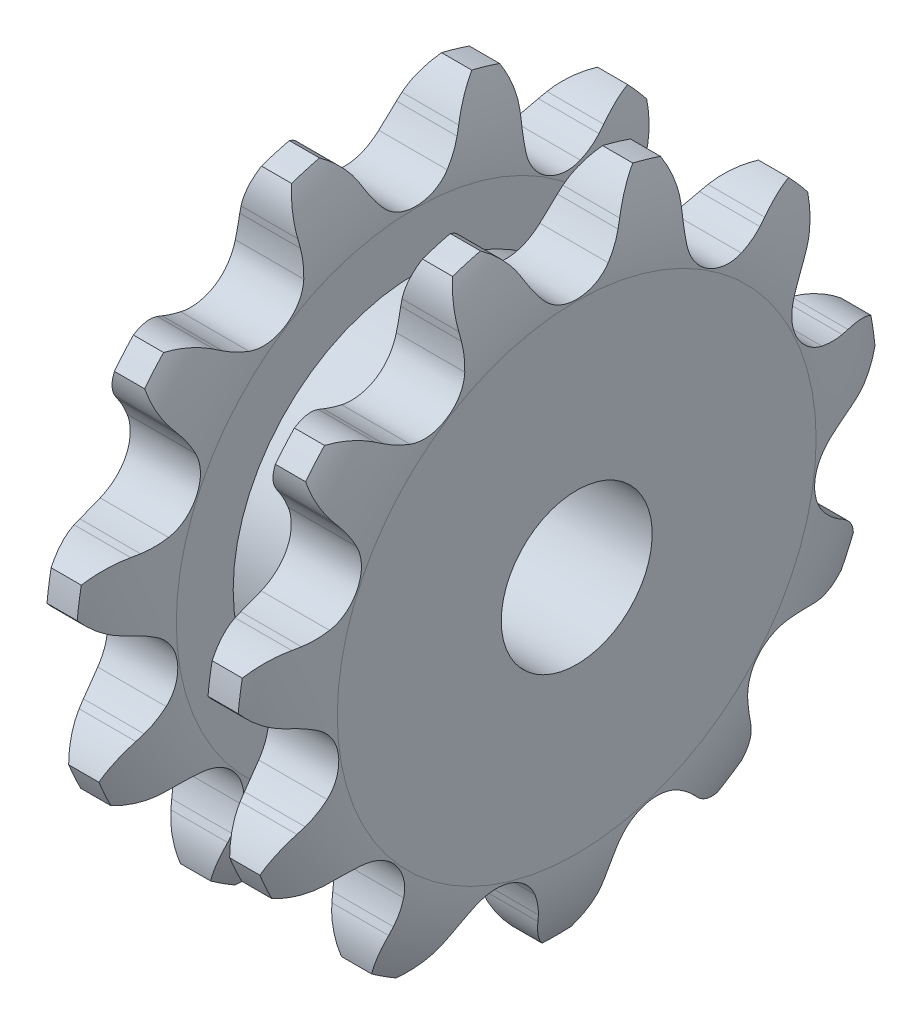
SolidWorks part; units mm, degrees
ref_plane "Plane1" through (0, 0, 0) normal (0, 0, 1) x (1, 0, 0)
ref_plane "Plane2" through (0, 0, 0) normal (0, 1, 0) x (1, 0, 0)
ref_plane "Plane3" through (0, 0, 0) normal (1, 0, 0) x (0, 0, -1)
sketch "Clipboard" plane through (0, 0, 0) normal (0, 1, 0) x (1, 0, 0)
  line L0 (0, 0) -> (6.2333, -1.2116)
  line L1 (-15, 0) -> (100, 0) construction
  line L2 (0, 0) -> (-0.5301, 0.5991)
  line L3 (0, 0) -> (-2.9891, 1.1425)
  line L4 (0, 0) -> (3.043, 0.5915)
  line L5 (0, 0) -> (-89.0105, -33.1983)
  line L6 (0, 0) -> (-7.6265, -5.1456)
  line L7 (-0.5301, 0.5991) -> (92.0355, 21.9696)
  line L8 (-76.2, 38.1) -> (-75.2, 38.1)
  line L9 (-73.2358, 39.4872) -> (-73.0836, 39.4947)
  line L10 (-73.0533, 76.1892) -> (-66.6533, 76.1892)
  circle A0 centre (0, 0) radius 1.651
  circle A1 centre (0, 0) radius 4
  circle A2 centre (0, 0) radius 4
sketch "BasProSke" plane through (0, 0, 0) normal (0, 1, 0) x (1, 0, 0)
  line L0 (-10, 0) -> (60, 0) construction
  line L1 (0, 0) -> (0, 9.5181)
  line L2 (0, 0) -> (9.2, 0)
  line L3 (9.2, 0) -> (9.2, 9.5181)
  line L4 (8.4, 12.7181) -> (0.8, 12.7181)
  arc A0 (0, 9.5181) -> (0.8, 12.7181) centre (6.8, 9.5181) cw
  arc A1 (9.2, 9.5181) -> (8.4, 12.7181) centre (2.4, 9.5181) ccw
revolve "Base-Revolve" add sketch "BasProSke" angle 360 about L0
sketch "GrvSke" plane through (0, 0, 0) normal (0, 1, 0) x (1, 0, 0)
  line L0 (2.8, 9.5181) -> (2.8, 7.2571)
  line L1 (2.8, 7.2571) -> (6.4, 7.2571)
  line L2 (6.4, 7.2571) -> (6.4, 9.5181)
  line L3 (2, 12.7181) -> (7.2, 12.7181)
  line L4 (4.6, 0) -> (4.6, 52.07) construction
  line L5 (-10, 0) -> (60, 0) construction
  line L6 (0, 0) -> (35.56, 0) construction
  arc A0 (6.4, 9.5181) -> (7.2, 12.7181) centre (13.2, 9.5181) cw
  arc A1 (2.8, 9.5181) -> (2, 12.7181) centre (-4, 9.5181) ccw
revolve "Groove" cut sketch "GrvSke" angle 360 about L6
pattern_linear "Grooves" [suppressed]
sketch "TooCutSke" plane through (0, 0, 0) normal (1, 0, 0) x (0, 0, -1)
  line L0 (1.8371, 10.977) -> (1.9787, 11.2486)
  line L1 (0, 0) -> (0, 107) construction
  line L2 (0, 11.2696) -> (-10, 11.2696) construction
  line L3 (-1.8371, 10.977) -> (-1.9787, 11.2486)
  arc A0 (1.2916, 10.1682) -> (1.8371, 10.977) centre (-2.01, 12.9835) ccw
  arc A1 (1.2916, 10.1682) -> (-1.2916, 10.1682) centre (0, 11.2696) cw
  arc A2 (1.9787, 11.2486) -> (4.4355, 12.7381) centre (4.4355, 9.9672) cw
  arc A3 (-1.2916, 10.1682) -> (-1.8371, 10.977) centre (2.01, 12.9835) cw
  arc A4 (-1.9787, 11.2486) -> (-4.4355, 12.7381) centre (-4.4355, 9.9672) ccw
  arc A5 (4.4355, 12.7381) -> (-4.4355, 12.7381) centre (0, 0) ccw
extrude "ToothCut" cut sketch "TooCutSke" along normal through all
pattern_circular "TeethCuts" count 11 every 32.727 about axis through (-10, 0, 0) along (1, 0, 0) of "ToothCut"
sketch "HubNeaOneSke" plane through (0, 0, 0) normal (-1, 0, 0) x (0, 0, 1)
  circle A0 centre (0, 0) radius 4
extrude "HubNearOne" [suppressed] add sketch "HubNeaOneSke" along normal blind 85.8005
sketch "HubNeaBotSke" plane through (0, 0, 0) normal (-1, 0, 0) x (0, 0, 1)
  circle A0 centre (0, 0) radius 4
extrude "HubNearBoth" [suppressed] add sketch "HubNeaBotSke" along normal blind 42.9002
ref_plane "FarPln" through (9.2, 0, 0) normal (1, 0, 0) x (0, 0, -1)
sketch "HubFarSke" plane through (9.2, 0, 0) normal (1, 0, 0) x (0, 0, -1)
  circle A0 centre (0, 0) radius 4
extrude "HubFar" [suppressed] add sketch "HubFarSke" along normal blind 42.9002
sketch "BorSke" plane through (0, 0, 0) normal (1, 0, 0) x (0, 0, -1)
  circle A0 centre (0, 0) radius 3
extrude "Bore" cut sketch "BorSke" along normal mid plane 190.001
sketch "KeySke" plane through (0, 0, 0) normal (1, 0, 0) x (0, 0, -1)
  line L0 (-1, 0) -> (-1, 4)
  line L1 (-1, 4) -> (1, 4)
  line L2 (1, 4) -> (1, 0)
  line L3 (0, 0) -> (0, 34) construction
  line L4 (-1, 0) -> (1, 0)
extrude "Keyway" [suppressed] cut sketch "KeySke" along normal mid plane 190.001
pattern_circular "Keyway2" [suppressed] count 2 every 90 about axis through (-10, 0, 0) along (1, 0, 0)
equation "' \"Pitch@Clipboard\" = 6.35"
equation "' \"Num_strands@Clipboard\" = 2"
equation "' \"Num_teeth@Clipboard\" = 11"
equation "' \"Hub_dia@Clipboard\" = 8"
equation "' \"Overall_len@Clipboard\" = 95"
equation "' \"Diameter@BorSke\" = 6"
equation "' \"T_dim@Clipboard\" = 1"
equation "' \"Width@KeySke\" = 2"
equation "' \"Dr@Clipboard\" = 3.302"
equation "' \"Face_width@Clipboard\" = 2.8"
equation "' \"Chamfer_dep@Clipboard\" = 3.2"
equation "' \"Chamfer_wid@Clipboard\" = 0.8"
equation "' \"Transv_pitch@Clipboard\" = 6.4"
equation "' \"Show_teeth@Clipboard\" = 11"
equation "\"Num_teeth@Clipboard\" = int( \"Num_teeth@Clipboard\" )"
equation "\"Num_teeth@Clipboard\" = ((sgn( \"Num_teeth@Clipboard\" - 5.0)+1)*( \"Num_teeth@Clipboard\" - 5.0))/2 +5.0"
equation "\"Num_teeth@Clipboard\" = ((sgn( \"Num_teeth@Clipboard\" - 200.0)-1)*( \"Num_teeth@Clipboard\" - 200.0))/-2 +200.0"
equation "\"MHD@Clipboard\" = \"Pitch@Clipboard\" * (1.0 / tan(3.14159265 / \"Num_teeth@Clipboard\" ) - 1.0) - 0.762"
equation "\"Thickness@Clipboard\"  = \"Face_width@Clipboard\" + (\"Num_strands@Clipboard\" - 1) * \"Transv_pitch@Clipboard\""
equation "\"OAL@Clipboard\" = \"Thickness@Clipboard\""
equation "\"MHD@Clipboard\" = ((sgn( \"MHD@Clipboard\" - \"Hub_dia@Clipboard\" )-1)*( \"MHD@Clipboard\" - \"Hub_dia@Clipboard\" ))/-2+ \"Hub_dia@Clipboard\""
equation "\"OAL@Clipboard\" = ((sgn( \"OAL@Clipboard\" - \"Overall_len@Clipboard\" )+1)*( \"OAL@Clipboard\" - \"Overall_len@Clipboard\" ))/2 + \"Overall_len@Clipboard\" + 0.0005"
equation "\"Num_teeth@TeethCuts\" = int( \"Show_teeth@Clipboard\" ) + 1"
equation "\"Num_teeth@TeethCuts\" = ((sgn( \"Num_teeth@TeethCuts\" - \"Num_teeth@Clipboard\" )-1)*( \"Num_teeth@TeethCuts\" - \"Num_teeth@Clipboard\" ))/-2+ \"Num_teeth@Clipboard\""
equation "\"Num_teeth@TeethCuts\" = ((sgn( \"Num_teeth@TeethCuts\" - 2.0)+1)*( \"Num_teeth@TeethCuts\" - 2.0))/2 +2.0"
equation "\"Angle@TeethCuts\" = 360.0 / \"Num_teeth@Clipboard\""
equation "\"Pitch_radius@TooCutSke\" = ( \"Pitch@Clipboard\" / 2.0) / sin(3.14159265 / \"Num_teeth@Clipboard\" )  'ma"
equation "\"R@TooCutSke\"  = \"Dr@Clipboard\" * 0.5025 + 0.0381"
equation "\"A@TooCutSke\" = 35.0 + (60.0 / \"Num_teeth@Clipboard\")"
equation "\"E@TooCutSke\"  = \"Dr@Clipboard\" * 1.3025 + 0.0381"
equation "\"B@TooCutSke\"  = 18.0 - (56.0 / \"Num_teeth@Clipboard\" )"
equation "\"W@TooCutSke\" = 1.4 * \"Dr@Clipboard\" * cos(3.14159265 / \"Num_teeth@Clipboard\" )"
equation "\"V@TooCutSke\" = 1.4 * \"Dr@Clipboard\" * sin(3.14159265 / \"Num_teeth@Clipboard\" )"
equation "\"Diameter@BasProSke\" = 2.0 * ( (0.3 * \"Pitch@Clipboard\" ) +  \"Pitch@Clipboard\" / 2.0 / tan(3.14159265 / \"Num_teeth@Clipboard\" ))"
equation "\"Thickness@BasProSke\"  = \"Thickness@Clipboard\""
equation "\"G1@BasProSke\" =  \"Chamfer_wid@Clipboard\""
equation "\"G2@BasProSke\" =  \"Chamfer_wid@Clipboard\""
equation "\"H1@BasProSke\" =  \"Chamfer_dep@Clipboard\""
equation "\"H2@BasProSke\" =  \"Chamfer_dep@Clipboard\""
equation "\"Diameter@GrvSke\" = \"Diameter@BasProSke\""
equation "\"G1@GrvSke\" = \"Chamfer_wid@Clipboard\""
equation "\"H1@GrvSke\" = \"Chamfer_dep@Clipboard\""
equation "\"Grv_diam@GrvSke\" =  \"Pitch@Clipboard\" * (1.0 / tan(3.14159265 / \"Num_teeth@Clipboard\" ) - 1.0) - 0.762"
equation "\"Grv_width@GrvSke\" =  \"Transv_pitch@Clipboard\" - \"Face_width@Clipboard\""
equation "\"Offset@GrvSke\" = \"Grv_width@GrvSke\" / 2.0 + \"Face_width@Clipboard\""
equation "\"Offset@Grooves\" = \"Transv_pitch@Clipboard\""
equation "\"Num_grvs@Grooves\" = \"Num_strands@Clipboard\""
equation "\"Num_grvs@Grooves\" = \"Num_grvs@Grooves\" - 1 * sgn( \"Num_grvs@Grooves\" -1)"
equation "\"Diameter@HubNeaOneSke\" = \"MHD@Clipboard\""
equation "\"Length@HubNearOne\" = \"OAL@Clipboard\" - \"Thickness@BasProSke\""
equation "\"Diameter@HubNeaBotSke\" = \"MHD@Clipboard\""
equation "\"Length@HubNearBoth\" = ( \"OAL@Clipboard\" - \"Thickness@BasProSke\" ) / 2.0"
equation "\"Thickness@FarPln\" = \"Thickness@BasProSke\""
equation "\"Diameter@HubFarSke\" = \"MHD@Clipboard\""
equation "\"Length@HubFar\" = ( \"OAL@Clipboard\" - \"Thickness@BasProSke\" ) / 2.0"
equation "\"D1@Bore\" = \"OAL@Clipboard\" * 2.0"
equation "\"D1@Keyway\" = \"OAL@Clipboard\" * 2.0"
equation "\"Offset@KeySke\" = \"T_dim@Clipboard\" + \"Diameter@BorSke\" / 2.0"
